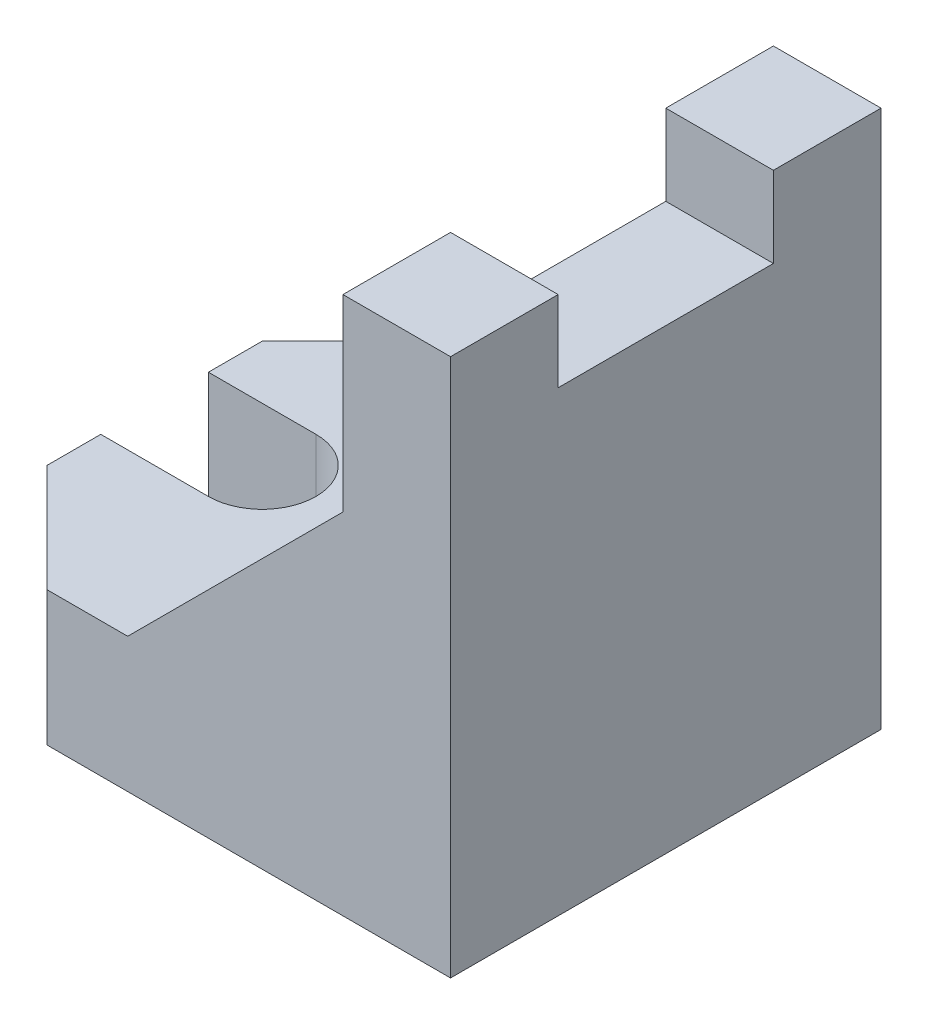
SolidWorks part; units mm, degrees
ref_plane "前视基准面" through (0, 0, 0) normal (0, 0, 1) x (1, 0, 0)
ref_plane "上视基准面" through (0, 0, 0) normal (0, 1, 0) x (1, 0, 0)
ref_plane "右视基准面" through (0, 0, 0) normal (1, 0, 0) x (0, 0, -1)
sketch "草图1" plane through (0, 0, 0) normal (0, 0, 1) x (1, 0, 0)
  line L0 (0, 0) -> (95, 0)
  line L1 (95, 0) -> (95, 100)
  line L2 (95, 100) -> (75, 100)
  line L3 (75, 100) -> (75, 65)
  line L4 (75, 65) -> (35, 25)
  line L5 (35, 25) -> (0, 25)
  line L6 (0, 25) -> (0, 0)
  dimension "D1" = 100
  dimension "D2" = 20
  dimension "D3" = 25
  dimension "D4" = 35
  dimension "D5" = 35
  dimension "D6" = 45
extrude "拉伸1" add sketch "草图1" along normal mid plane 80
chamfer "倒角1" distance 20 angle 45 2 edges at (0, 12.5, -40) (0, 12.5, 40)
sketch "草图2" plane through (0, 25, 0) normal (0, 1, 0) x (1, 0, 0)
  line L0 (0, 0) -> (20, 0) construction
  line L1 (0, -10) -> (20, -10)
  line L2 (0, 10) -> (20, 10)
  arc A0 (0, -10) -> (0, 10) centre (0, 0) cw
  arc A1 (20, -10) -> (20, 10) centre (20, 0) ccw
  dimension "D3" = 20
  dimension "D1" = 10
  dimension "D2" = 10
extrude "切除-拉伸1" cut sketch "草图2" against normal through all
ref_plane "基准面1" through (0, 0, 0) normal (0, 0, 1) x (1, 0, 0)
sketch "草图3" plane through (0, 0, 0) normal (0, 0, 1) x (1, 0, 0)
  line L0 (35, 25) -> (75, 65)
  line L1 (75, 65) -> (75, 25)
  line L2 (75, 25) -> (35, 25)
extrude "切除-拉伸2" cut sketch "草图3" against normal mid plane 40
sketch "草图4" plane through (75, 0, 0) normal (-1, 0, 0) x (0, 0, 1)
  line L0 (0, 100) -> (0, 80.4523) construction
  line L1 (40, 100) -> (-40, 100) construction
  line L2 (0, -41.25) -> (0, 41.25) construction
  line L3 (20, 65) -> (20, 25) construction
  line L4 (-20, 100) -> (20, 100)
  line L5 (-20, 100) -> (-20, 85)
  line L6 (-20, 85) -> (20, 85)
  line L7 (20, 100) -> (20, 85)
  dimension "D1" = 15
extrude "切除-拉伸3" cut sketch "草图4" against normal through all
